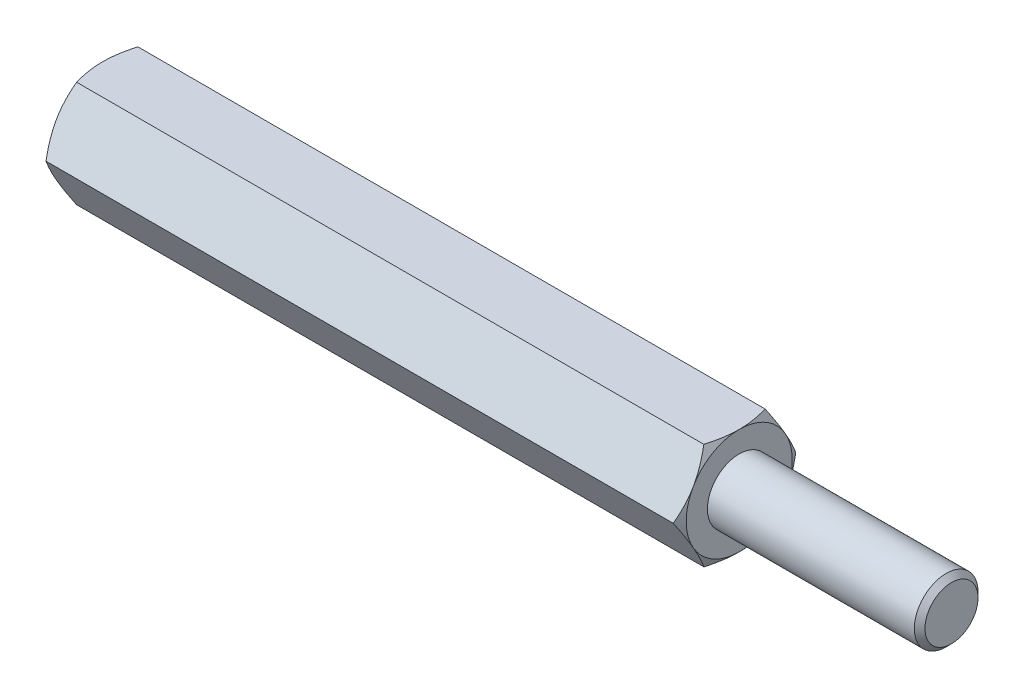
SolidWorks part; units mm, degrees
ref_plane "Front Plane" through (0, 0, 0) normal (0, 0, 1) x (1, 0, 0)
ref_plane "Top Plane" through (0, 0, 0) normal (0, 1, 0) x (1, 0, 0)
ref_plane "Right Plane" through (0, 0, 0) normal (1, 0, 0) x (0, 0, -1)
sketch "Sketch1" plane through (0, 0, 0) normal (1, 0, 0) x (0, 0, -1)
  line L1 (1.4434, 2.5) -> (-1.4434, 2.5)
  line L2 (-1.4434, 2.5) -> (-2.8868, 0)
  line L3 (-2.8868, 0) -> (-1.4434, -2.5)
  line L4 (-1.4434, -2.5) -> (1.4434, -2.5)
  line L5 (1.4434, -2.5) -> (2.8868, 0)
  line L6 (2.8868, 0) -> (1.4434, 2.5)
  circle A0 centre (0, 0) radius 2.5 construction
  dimension "D1" = 5
extrude "Extrude2" add sketch "Sketch1" along normal mid plane 30
sketch "Sketch2" plane through (0, 0, 0) normal (0, 0, 1) x (1, 0, 0)
  line L0 (-15, 2.5) -> (-13.5, 5.0981)
  line L1 (-15, 5.5) -> (-15, 2.5)
  line L3 (0, 0) -> (50000, 0) construction
  arc A0 (-13.5, 5.0981) -> (-15, 5.5) centre (-14.1962, 5.5) ccw
  dimension "D1" = 30
  dimension "D2" = 3
revolve "Cut-Revolve1" cut sketch "Sketch2" angle 360 about L3
mirror "Mirror1" about plane through (0, 0, 0) normal (1, 0, 0) of "Cut-Revolve1"
sketch "Sketch3" plane through (-15, 0, 0) normal (-1, 0, 0) x (0, 0, 1)
  circle A0 centre (0, 0) radius 1.25
  dimension "D1" = 2.5
extrude "Extrude3" cut sketch "Sketch3" against normal blind 10
sketch "Sketch4" plane through (0, 0, 0) normal (0, 0, 1) x (1, 0, 0)
  line L0 (-5, 0) -> (-5, 1.25)
  line L1 (14.7767, 0) -> (-14.7767, 0) construction
  line L2 (-5, 1.25) -> (-4.2783, 0)
  line L3 (-4.2783, 0) -> (-5, 0)
  line L4 (-15, 1.25) -> (-15, -1.25) construction
  point P4 (-15, 0)
  dimension "D1" = 30
  dimension "D2" = 1.25
  dimension "D3" = 10
revolve "Cut-Revolve2" cut sketch "Sketch4" angle 360 about L3
sketch "Sketch5" plane through (15, 0, 0) normal (1, 0, 0) x (0, 0, -1)
  circle A0 centre (0, 0) radius 1.5
  dimension "D1" = 3
extrude "Extrude4" add sketch "Sketch5" along normal blind 10
chamfer "Chamfer1" distance 0.25 angle 45 1 edges at (25, 0, -1.5)
equation "\"D2@Sketch4\" = \"D1@Sketch3\"/2"
